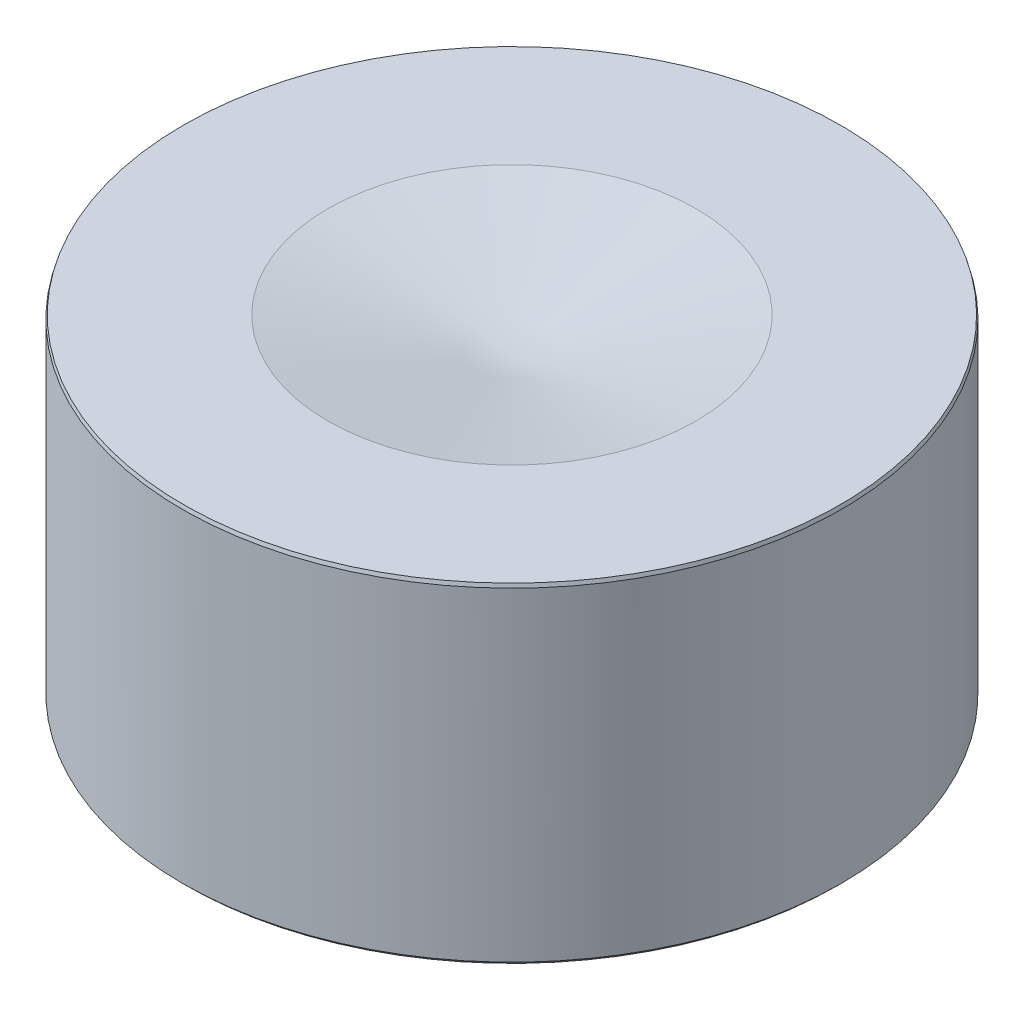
SolidWorks part; units mm, degrees
ref_plane "Front Plane" through (0, 0, 0) normal (0, 0, 1) x (1, 0, 0)
ref_plane "Top Plane" through (0, 0, 0) normal (0, 1, 0) x (1, 0, 0)
ref_plane "Right Plane" through (0, 0, 0) normal (1, 0, 0) x (0, 0, -1)
sketch "Sketch1" plane through (0, 0, 0) normal (0, 0, 1) x (1, 0, 0)
  line L0 (-8.955, 0) -> (-8.955, 9)
  line L1 (-8.955, 9) -> (-5, 9)
  line L2 (-5, 9) -> (0, 8)
  line L3 (0, 8) -> (0, 6)
  line L4 (0, 6) -> (-7.5, 6)
  line L5 (-7.5, 6) -> (-7.5, 0)
  line L6 (-7.5, 0) -> (-8.955, 0)
  point P10 (-1.9575, 6.4337)
  point P11 (-6.4462, 8.3853)
  dimension "D1" = 8.955
  dimension "D2" = 7.5
  dimension "D3" = 6
  dimension "D4" = 9
  dimension "D5" = 1
  dimension "D6" = 5
revolve "Revolve1" add sketch "Sketch1" angle 360 about L3
chamfer "Chamfer1" distance 0.1 angle 45 2 edges at (-8.955, 0, 0) (-7.5, 0, 0)
fillet "Fillet1" radius 0.3 1 edges at (-7.5, 6, 0)
chamfer "Chamfer2" distance 0.1 angle 15 1 edges at (-8.955, 9, 0)
